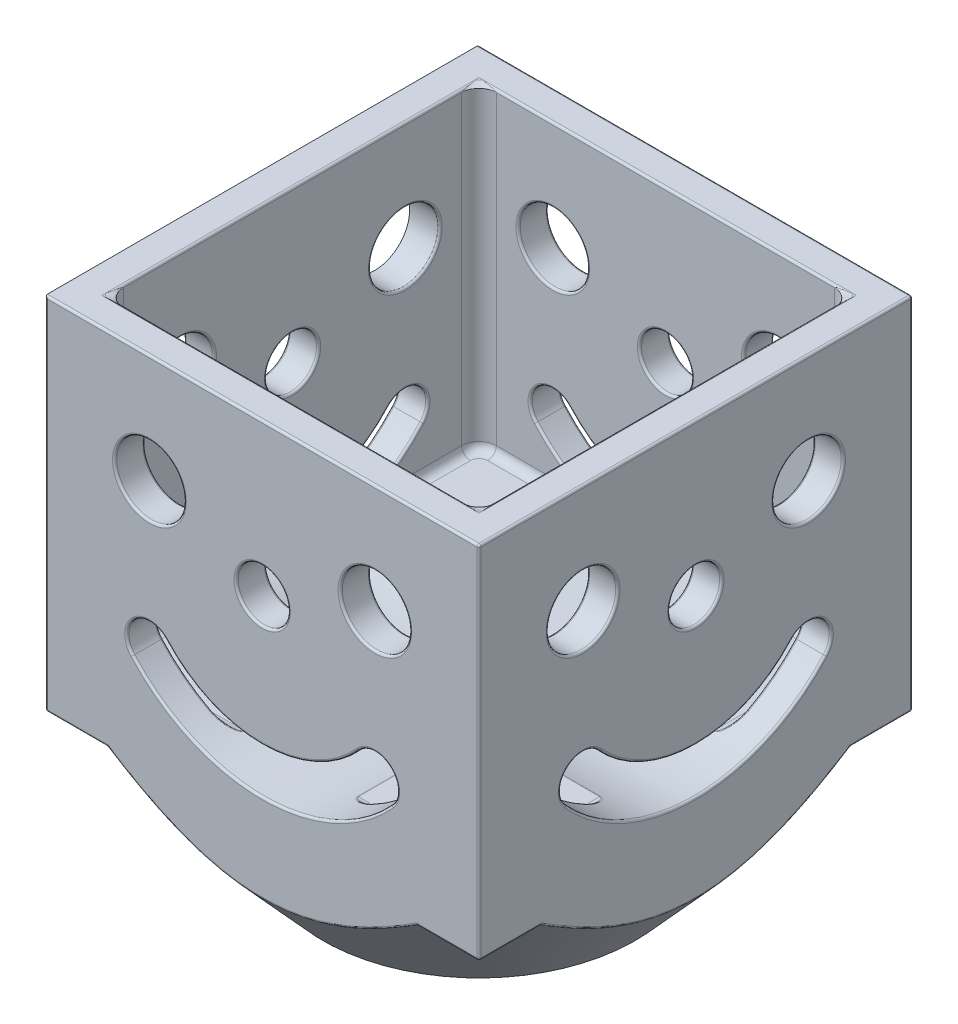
SolidWorks part; units mm, degrees
ref_plane "前视基准面" through (0, 0, 0) normal (0, 0, 1) x (1, 0, 0)
ref_plane "上视基准面" through (0, 0, 0) normal (0, 1, 0) x (1, 0, 0)
ref_plane "右视基准面" through (0, 0, 0) normal (1, 0, 0) x (0, 0, -1)
sketch "草图1" plane through (0, 0, 0) normal (0, 0, 1) x (1, 0, 0)
  line L1 (-50, 50) -> (50, 50)
  line L2 (-50, 50) -> (-50, -50)
  line L3 (-50, -50) -> (50, -50)
  line L4 (50, 50) -> (50, -50)
extrude "凸台-拉伸2" add sketch "草图1" along normal blind 100
sketch "草图3" plane through (0, 0, 100) normal (0, 0, 1) x (1, 0, 0)
  line L0 (50, -30) -> (25, -50)
  line L1 (-50, -30) -> (-25, -50)
  line L6 (-50, -50) -> (-50, -30)
  line L7 (-50, -50) -> (-25, -50)
  line L8 (50, -30) -> (50, -50)
  line L11 (25, -50) -> (50, -50)
extrude "切除-拉伸2" cut sketch "草图3" against normal blind 100
sketch "草图4" plane through (0, 0, 100) normal (0, 0, 1) x (1, 0, 0)
  line L6 (43, -23) -> (43, 72.8608)
  line L7 (-43, 72.8608) -> (43, 72.8608)
  line L8 (-43, -23) -> (-43, 72.8608)
  line L11 (-43, -23) -> (43, -23)
extrude "切除-拉伸4" cut sketch "草图4" against normal blind 93
sketch "草图5" plane through (0, 0, 100) normal (0, 0, 1) x (1, 0, 0)
  line L0 (50, -30) -> (50, 50) construction
  line L1 (-50, 50) -> (50, 50)
  line L2 (-50, 50) -> (-50, -26.389)
  line L3 (-50, -26.389) -> (50, -26.389)
  line L4 (50, 50) -> (50, -26.389)
extrude "凸台-拉伸3" add sketch "草图5" against normal blind 7
sketch "草图6" plane through (0, 0, 100) normal (0, 0, 1) x (1, 0, 0)
  circle A2 centre (0, 15) radius 6
  circle A3 centre (-26, 25) radius 8
  arc A4 (-29.8629, -11.9119) -> (29.8629, -11.9119) centre (0, 15) ccw
  arc A5 (-22.1371, -4.9496) -> (22.1371, -4.9496) centre (0, 15) ccw
  circle A6 centre (26, 25) radius 8
  arc A8 (-22.1371, -4.9496) -> (-29.8629, -11.9119) centre (-26, -8.4307) ccw
  arc A9 (29.8629, -11.9119) -> (22.1371, -4.9496) centre (26, -8.4307) ccw
extrude "切除-拉伸9" cut sketch "草图6" against normal blind 120
sketch "草图10" plane through (0, 0, 100) normal (0, 0, 1) x (1, 0, 0)
  line L2 (-50, -28.1428) -> (-50, -50)
  line L3 (-50, -50) -> (50, -50)
  line L4 (50, -28.1428) -> (50, -50)
  line L6 (-50, -28.1428) -> (50, -28.1428)
extrude "凸台-拉伸5" add sketch "草图10" against normal blind 100
sketch "草图12" plane through (-50, 0, 0) normal (-1, 0, 0) x (0, 0, 1)
  circle A0 centre (24, 25) radius 8
  circle A1 centre (76, 25) radius 8
extrude "切除-拉伸10" cut sketch "草图12" against normal blind 120
sketch "草图13" plane through (-50, 0, 0) normal (-1, 0, 0) x (0, 0, 1)
  circle A0 centre (50, 15) radius 6
extrude "切除-拉伸12" cut sketch "草图13" against normal blind 150
sketch "草图15" plane through (-50, 0, 0) normal (-1, 0, 0) x (0, 0, 1)
  arc A5 (27.8629, -4.9496) -> (20.1371, -11.9119) centre (24, -8.4307) ccw
  arc A6 (79.8629, -11.9119) -> (72.1371, -4.9496) centre (76, -8.4307) ccw
  arc A9 (27.8629, -4.9496) -> (72.1371, -4.9496) centre (50, 15) ccw
  arc A10 (20.1371, -11.9119) -> (79.8629, -11.9119) centre (50, 15) ccw
extrude "切除-拉伸13" cut sketch "草图15" against normal blind 150
sketch "草图17" plane through (0, -50, 0) normal (0, -1, 0) x (1, 0, 0)
  line L1 (0, 124.769) -> (67.2774, 124.769)
  line L2 (0, 124.769) -> (0, 54.7006)
  line L4 (67.2774, 124.769) -> (67.2774, 54.7006)
  line L5 (0, 54.7006) -> (67.2774, 54.7006)
extrude "凸台-拉伸6" add sketch "草图17" along normal blind 30
sketch "草图19" plane through (0, -50, 0) normal (0, -1, 0) x (1, 0, 0)
  circle A0 centre (0, 54.7006) radius 108.0086
extrude "切除-拉伸14" cut sketch "草图19" along normal blind 30
sketch "草图20" plane through (0, -50, 0) normal (0, -1, 0) x (1, 0, 0)
  circle A0 centre (0, 50) radius 70.7107
extrude "凸台-拉伸9" add sketch "草图20" along normal blind 60
sketch "草图22" plane through (0, -110, 0) normal (0, -1, 0) x (1, 0, 0)
  line L2 (0, 50) -> (0, 17.4469)
  line L5 (0, 50) -> (32.4206, 50)
  line L7 (0, 17.4469) -> (32.4206, 17.4469)
  line L8 (32.4206, 50) -> (32.4206, 17.4469)
extrude "凸台-拉伸10" add sketch "草图22" along normal blind 20
sketch "草图23" plane through (0, 0, 0) normal (-1, 0, 0) x (0, 0, 1)
  line L1 (-11.2046, -33.0146) -> (50, -100.6516)
  line L2 (50, -100.6516) -> (50, -133.2722)
  line L3 (-35.4659, -33.0146) -> (-11.2046, -33.0146)
  line L9 (-35.4659, -33.0146) -> (-35.4659, -133.2722)
  line L11 (-35.4659, -133.2722) -> (50, -133.2722)
revolve "切除-旋转7" cut sketch "草图23" angle 360 about L2
sketch "草图24" plane through (0, 0, 100) normal (0, 0, 1) x (1, 0, 0)
  line L1 (-18.3008, 61.898) -> (26.0879, 61.898)
  line L2 (-18.3008, 61.898) -> (-18.3008, -60.8597)
  line L3 (-18.3008, -60.8597) -> (26.0879, -60.8597)
  line L4 (26.0879, 61.898) -> (26.0879, -60.8597)
extrude "凸台-拉伸11" add sketch "草图24" along normal blind 20
sketch "草图25" plane through (0, -60.8597, 0) normal (0, -1, 0) x (1, 0, 0)
  circle A0 centre (0, 48.5423) radius 85.93
extrude "切除-拉伸16" cut sketch "草图25" along normal blind 50
sketch "草图26" plane through (0, 0, 100) normal (0, 0, 1) x (1, 0, 0)
  line L1 (-75.3031, 103.7363) -> (74.8703, 103.7363)
  line L2 (-75.3031, 103.7363) -> (-75.3031, -95.3409)
  line L3 (-75.3031, -95.3409) -> (74.8703, -95.3409)
  line L4 (74.8703, 103.7363) -> (74.8703, -95.3409)
extrude "切除-拉伸17" cut sketch "草图26" along normal blind 50
sketch "草图27" plane through (0, -60.8597, 0) normal (0, -1, 0) x (1, 0, 0)
  circle A0 centre (0, 50) radius 10.13
extrude "切除-拉伸19" cut sketch "草图27" against normal blind 30
sketch "草图28" plane through (0, -60.8597, 0) normal (0, -1, 0) x (1, 0, 0)
  circle A0 centre (0, 50) radius 8.5
extrude "切除-拉伸20" cut sketch "草图28" against normal blind 80
fillet "圆角1" radius 0.5 38 edges at (-50, 17, 76) (6, 15, 0) (-18, 25, 0) (-29.4811, -4.5679, 0) (0, -14.8, 0) (29.4811, -4.5679, 0) (0, -25.2, 0) (34, 25, 0) (0, 50, 0) (-50, 8.4927, 0) (-42.6494, -33.0146, 0) (-11.3944, -43.9801, 0) (42.6494, -33.0146, 0) (50, 17, 24) (50, 17, 76) (50, 9, 50) (50, -25.2, 50) (50, -4.5679, 20.5189) (50, -14.8, 50) (50, -4.5679, 79.4811) (50, 50, 50) (50, 8.4927, 0) (50, -33.0146, 7.3506) (50, -43.9801, 38.6056) (50, -33.0146, 92.6494) (6, 15, 100) (-18, 25, 100) (50, 8.4927, 100) (42.6494, -33.0146, 100) (-11.3944, -43.9801, 100) (-42.6494, -33.0146, 100) (-50, 8.4927, 100) (0, 50, 100) (34, 25, 100) (0, -14.8, 100) (-29.4811, -4.5679, 100) (0, -25.2, 100) (29.4811, -4.5679, 100)
fillet "圆角2" radius 0.5 4 edges at (0, 50, 7) (-43, 50, 50) (0, 50, 93) (43, 50, 50)
fillet "圆角3" radius 0.5 21 edges at (-49.8536, -32.8681, 0.1464) (-49.8536, -32.8681, 99.8536) (-50, -33.0146, 7.6006) (-50, -33.0146, 92.3994) (-35.699, -32.7896, 99.9175) (35.699, -32.7896, 0.0825) (49.9172, -32.7901, 14.3008) (-35.6992, -32.7901, 0.0828) (35.6992, -32.7901, 99.9172) (49.9175, -32.7896, 85.699) (-43.5806, -33.0146, 7.0264) (-50, -43.9801, 38.6056) (-43.5806, -33.0146, 92.9736) (-35.767, -32.9602, 99.7268) (35.8095, -32.9856, 99.6679) (49.7268, -32.9602, 85.767) (49.6679, -32.9856, 14.1905) (43.2782, -33.0146, 6.7218) (35.767, -32.9602, 0.2732) (-35.8095, -32.9856, 0.3321) (43.2782, -33.0146, 93.2782)
fillet "圆角4" radius 0.5 3 edges at (0, -30.8597, 41.5) (0, -30.8597, 39.87) (0, -60.8597, 39.87)
fillet "圆角5" radius 4 8 edges at (43.1464, 49.8536, 93.1464) (-43.1464, 49.8536, 93.1464) (-43.1464, 49.8536, 6.8536) (43.1464, 49.8536, 6.8536) (43, 13.25, 93) (-43, 13.25, 93) (-43, 13.25, 7) (43, 13.25, 7)
fillet "圆角6" radius 2 12 edges at (43, -23, 76.0582) (41.8284, -23, 91.8284) (43, -23, 23.9418) (41.8284, -23, 8.1716) (-26.0582, -23, 93) (-41.8284, -23, 91.8284) (-26.0582, -23, 7) (-41.8284, -23, 8.1716) (26.0582, -23, 93) (26.0582, -23, 7) (-43, -23, 76.0582) (-43, -23, 23.9418)
fillet "圆角7" radius 0.5 4 edges at (43, 21, 50) (-18, 25, 93) (-43, 25, 32) (-18, 25, 7)
fillet "圆角8" radius 0.5 5 edges at (-50, 9, 50) (-50, -25.2, 50) (-50, -4.5679, 79.4811) (-50, -14.8, 50) (-50, -4.5679, 20.5189)
fillet "圆角9" radius 0.5 1 edges at (34, 25, 7)
fillet "圆角10" radius 0.5 9 edges at (13.1164, -23, 22.9418) (13.3165, -22.9303, 8.4767) (24.3048, -17.0206, 7) (29.4811, -4.5679, 7) (0, -14.8, 7) (-29.4811, -4.5679, 7) (-13.1164, -23, 22.9418) (-13.4414, -22.8863, 8.3352) (-24.3048, -17.0206, 7)
fillet "圆角11" radius 0.5 13 edges at (-27.0582, -23, 63.1164) (-41.6648, -22.8863, 63.4414) (-43, -17.0206, 74.3048) (-43, -4.5679, 79.4811) (-9.5629, -24.046, 40.4371) (-13.098, -23.0105, 36.9141) (-27.1, -23, 36.8836) (-41.5233, -22.9303, 36.6835) (-43, -17.0206, 25.6952) (-43, -4.5679, 20.5189) (-43, -14.8, 50) (-43, 15, 56) (-43, 25, 84)
fillet "圆角12" radius 0.5 13 edges at (13.1164, -23, 77.0582) (13.4414, -22.8863, 91.6648) (24.3048, -17.0206, 93) (29.4811, -4.5679, 93) (-9.5629, -24.046, 59.5629) (-13.0859, -23.0105, 63.098) (-13.1164, -23, 77.1) (-13.3165, -22.9303, 91.5233) (-24.3048, -17.0206, 93) (-29.4811, -4.5679, 93) (6, 15, 93) (0, -14.8, 93) (34, 25, 93)
fillet "圆角13" radius 0.5 15 edges at (9.5629, -24.046, 40.4371) (13.1413, -23.0035, 36.8936) (27.1, -23, 36.8836) (41.6648, -22.8863, 36.5586) (43, -17.0206, 25.6952) (43, -4.5679, 20.5189) (9.5629, -24.046, 59.5629) (13.098, -23.0105, 63.0859) (27.1, -23, 63.1164) (41.5233, -22.9303, 63.3165) (43, -17.0206, 74.3048) (43, -4.5679, 79.4811) (43, -14.8, 50) (43, 33, 24) (43, 33, 76)
fillet "圆角14" radius 0.5 1 edges at (6, 15, 7)
fillet "圆角15" radius 0.5 8 edges at (-2.2471, -25.1371, 41.8024) (-8.1976, -25.1371, 52.2471) (2.2471, -25.1371, 58.1976) (8.1976, -25.1371, 47.7529)
